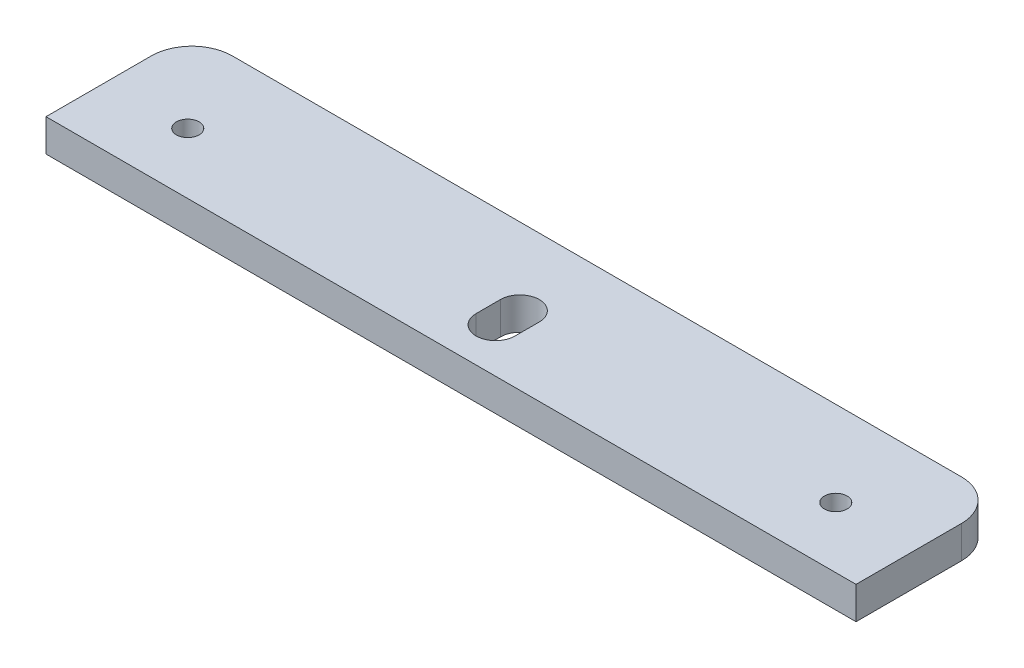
SolidWorks part; units mm, degrees
ref_plane "Front Plane" through (0, 0, 0) normal (0, 0, 1) x (1, 0, 0)
ref_plane "Top Plane" through (0, 0, 0) normal (0, 1, 0) x (1, 0, 0)
ref_plane "Right Plane" through (0, 0, 0) normal (1, 0, 0) x (0, 0, -1)
sketch "Sketch1" plane through (0, 0, 0) normal (0, 1, 0) x (1, 0, 0)
  line L1 (0, 0) -> (-63.5, 0)
  line L2 (0, 0) -> (0, 22.86)
  line L3 (0, 22.86) -> (-63.5, 22.86)
  line L4 (-63.5, 0) -> (-63.5, 22.86)
  dimension "D1" = 63.5
  dimension "D2" = 22.86
extrude "Plate" add sketch "Sketch1" along normal blind 5.08
fillet "Fillet1" radius 6.35 1 edges at (-63.5, 2.54, -22.86)
sketch "Sketch2" plane through (0, 5.08, 0) normal (0, 1, 0) x (1, 0, 0)
  line L2 (0, 10.795) -> (0, 6.985) construction
  line L3 (0, 0) -> (0, 22.86) construction
  line L4 (3.048, 10.795) -> (3.048, 6.985)
  line L5 (-3.048, 10.795) -> (-3.048, 6.985)
  line L6 (-63.5, 0) -> (0, 0) construction
  arc A1 (3.048, 10.795) -> (-3.048, 10.795) centre (0, 10.795) ccw
  arc A2 (-3.048, 6.985) -> (3.048, 6.985) centre (0, 6.985) ccw
  point P4 (0, 8.89)
  dimension "D1" = 8.89
  dimension "D3" = 3.81
  dimension "D2" = 6.096
extrude "MonitorScrewHole" cut sketch "Sketch2" against normal through all
sketch "Sketch3" plane through (0, 5.08, 0) normal (0, 1, 0) x (1, 0, 0)
  line L0 (0, 13.843) -> (0, 22.86) construction
  line L5 (-63.5, 0) -> (0, 0) construction
  circle A2 centre (-50.8, 9.525) radius 1.778
  dimension "D1" = 50.8
  dimension "D3" = 3.556
  dimension "D2" = 9.525
extrude "8-32TapHoles" cut sketch "Sketch3" against normal through all
mirror "Mirror1" about plane through (0, 5.08, 0) normal (-1, 0, 0) of "8-32TapHoles", "MonitorScrewHole", "Fillet1", "Plate"
